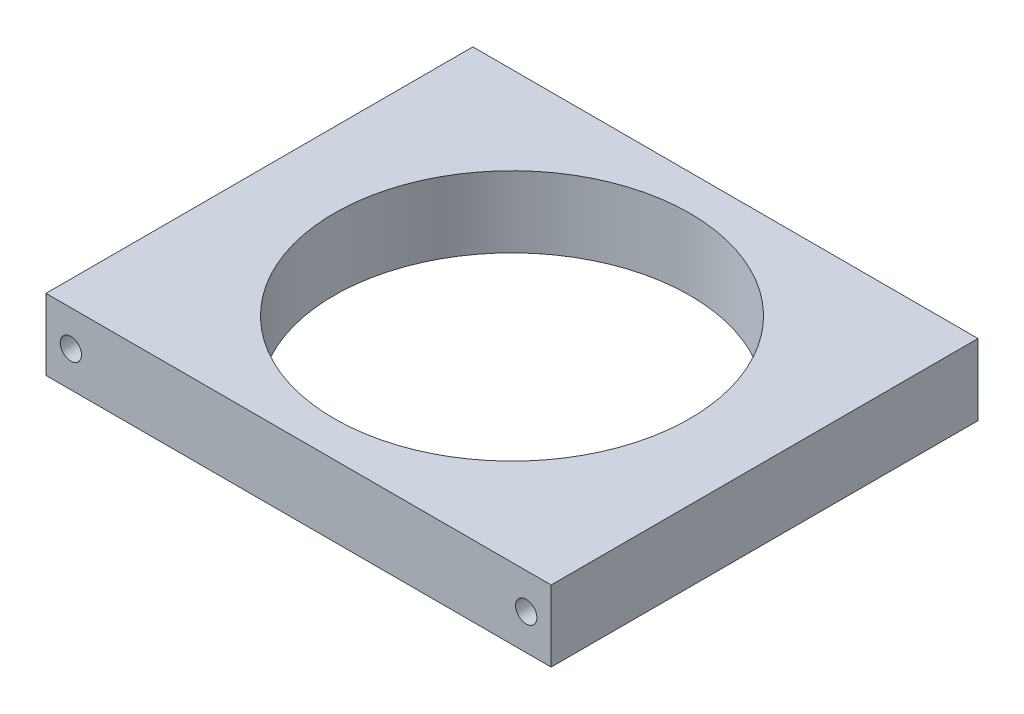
SolidWorks part; units mm, degrees
ref_plane "前视基准面" through (0, 0, 0) normal (0, 0, 1) x (1, 0, 0)
ref_plane "上视基准面" through (0, 0, 0) normal (0, 1, 0) x (1, 0, 0)
ref_plane "右视基准面" through (0, 0, 0) normal (1, 0, 0) x (0, 0, -1)
sketch "草图1" plane through (0, 0, 0) normal (0, 1, 0) x (1, 0, 0)
  line L1 (-35.5, 30) -> (35.5, 30)
  line L2 (-35.5, 30) -> (-35.5, -30)
  line L3 (-35.5, -30) -> (35.5, -30)
  line L4 (35.5, 30) -> (35.5, -30)
  line L5 (-35.5, 30) -> (35.5, -30) construction
  line L6 (-35.5, -30) -> (35.5, 30) construction
  point P0 (0, 0)
  dimension "D1" = 71
  dimension "D2" = 60
extrude "凸台-拉伸1" add sketch "草图1" along normal blind 10
sketch "草图2" plane through (0, 10, 0) normal (0, 1, 0) x (1, 0, 0)
  circle A0 centre (0, 0) radius 25
  dimension "D1" = 50
extrude "切除-拉伸1" cut sketch "草图2" against normal through all
sketch "草图3" plane through (0, 0, -30) normal (0, 0, -1) x (-1, 0, 0)
  line L0 (-32, 5) -> (32, 5) construction
  line L1 (0, 10) -> (0, 0) construction
  line L2 (-35.5, 10) -> (35.5, 10) construction
  circle A0 centre (-32, 5) radius 1.5
  circle A1 centre (32, 5) radius 1.5
  point P9 (0, 5)
  point P10 (0, 5)
  dimension "D2" = 3
  dimension "D3" = 3
  dimension "D1" = 64
extrude "切除-拉伸2" cut sketch "草图3" against normal through all
